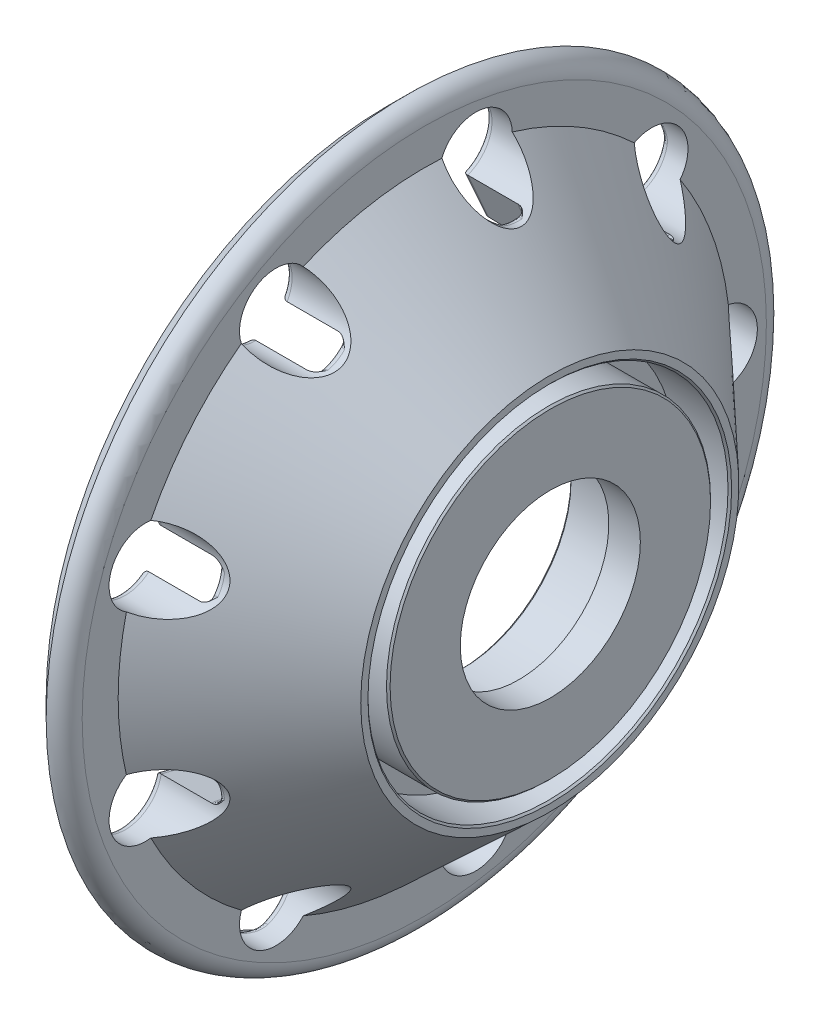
SolidWorks part; units mm, degrees
ref_plane "Plan de face" through (0, 0, 0) normal (0, 0, 1) x (1, 0, 0)
ref_plane "Plan de dessus" through (0, 0, 0) normal (0, 1, 0) x (1, 0, 0)
ref_plane "Plan de droite" through (0, 0, 0) normal (1, 0, 0) x (0, 0, -1)
ref_plane "Plan1" through (0, 0, 0) normal (0, 0, -1) x (-1, 0, 0)
sketch "Esquisse1" plane through (0, 0, 0) normal (0, 0, -1) x (-1, 0, 0)
  line L0 (0.0592, 21) -> (0.0592, 0)
  line L1 (0.0592, 0) -> (18, 0)
  line L2 (18, 0) -> (18, 38)
  line L3 (18, 38) -> (16, 40)
  line L4 (14, 38) -> (14, 34)
  line L5 (14, 34) -> (0.0592, 21)
  line L6 (0.0592, 0) -> (18, 0) construction
  arc A0 (16, 40) -> (14, 38) centre (16, 38) ccw
revolve "Révolution1" add sketch "Esquisse1" angle 360 about L6
sketch "Esquisse2" plane through (-18, 0, 0) normal (-1, 0, 0) x (0, 0, 1)
  line L0 (12.984, 26.489) -> (7.5426, 23.835)
  line L1 (7.5426, 23.835) -> (1.0643, 24.9773)
  line L2 (1.0643, 24.9773) -> (-3.1412, 29.3323)
  line L3 (-7.0805, 28.6377) -> (-9.5429, 23.107)
  line L4 (-9.5429, 23.107) -> (-15.2398, 19.8179)
  line L5 (-15.2398, 19.8179) -> (-21.2607, 20.4507)
  line L6 (-23.8319, 17.3865) -> (-22.1632, 11.567)
  line L7 (-22.1632, 11.567) -> (-24.4131, 5.3854)
  line L8 (-24.4131, 5.3854) -> (-29.4321, 2)
  line L9 (-29.4321, -2) -> (-24.4131, -5.3854)
  line L10 (-24.4131, -5.3854) -> (-22.1632, -11.567)
  line L11 (-22.1632, -11.567) -> (-23.8319, -17.3865)
  line L12 (-21.2607, -20.4507) -> (-15.2398, -19.8179)
  line L13 (-15.2398, -19.8179) -> (-9.5429, -23.107)
  line L14 (-9.5429, -23.107) -> (-7.0805, -28.6377)
  line L15 (-3.1412, -29.3323) -> (1.0643, -24.9773)
  line L16 (1.0643, -24.9773) -> (7.5426, -23.835)
  line L17 (7.5426, -23.835) -> (12.984, -26.489)
  line L18 (16.4481, -24.489) -> (16.8704, -18.4496)
  line L19 (16.8704, -18.4496) -> (21.0989, -13.4104)
  line L20 (21.0989, -13.4104) -> (26.9731, -11.9458)
  line L21 (28.3412, -8.187) -> (24.7827, -3.2891)
  line L22 (24.7827, -3.2891) -> (24.7827, 3.2891)
  line L23 (24.7827, 3.2891) -> (28.3412, 8.187)
  line L24 (26.9731, 11.9458) -> (21.0989, 13.4104)
  line L25 (21.0989, 13.4104) -> (16.8704, 18.4496)
  line L26 (16.8704, 18.4496) -> (16.4481, 24.489)
  arc A0 (-3.1412, 29.3323) -> (-7.0805, 28.6377) centre (-5.722, 32.4512) cw
  arc A1 (-21.2607, 20.4507) -> (-23.8319, 17.3865) centre (-25.2425, 21.181) cw
  arc A2 (-29.4321, 2) -> (-29.4321, -2) centre (-32.9518, 0) cw
  arc A3 (-23.8319, -17.3865) -> (-21.2607, -20.4507) centre (-25.2425, -21.181) cw
  arc A4 (-7.0805, -28.6377) -> (-3.1412, -29.3323) centre (-5.722, -32.4512) cw
  arc A5 (12.984, -26.489) -> (16.4481, -24.489) centre (16.4759, -28.5371) cw
  arc A6 (26.9731, -11.9458) -> (28.3412, -8.187) centre (30.9646, -11.2702) cw
  arc A7 (28.3412, 8.187) -> (26.9731, 11.9458) centre (30.9646, 11.2702) cw
  arc A8 (16.4481, 24.489) -> (12.984, 26.489) centre (16.4759, 28.5371) cw
extrude "Extrusion1" cut sketch "Esquisse2" against normal blind 8
draft "Dépouille1" type of draft neutral plane draft angle 2 faces to draft 9 parameters "D1"=2
ref_plane "Plan2" through (0, 28.5371, 0) normal (0, 1, 0) x (-1, 0, 0)
sketch "Esquisse3" plane through (0, 28.5371, 0) normal (0, 1, 0) x (-1, 0, 0)
  line L0 (8.5348, 16.4759) -> (8.5348, 12.4277)
  line L1 (8.5348, 12.4277) -> (14, 12.4277)
  line L2 (14, 12.4277) -> (14, 16.4759)
  line L3 (14, 16.4759) -> (8.5348, 16.4759)
  line L4 (14, 16.4759) -> (8.5348, 16.4759) construction
revolve "Révolution2" add sketch "Esquisse3" angle 360 about L3
ref_plane "Plan3" through (0, 0, 0) normal (0, 0.9397, 0.342) x (-1, 0, 0)
sketch "Esquisse4" plane through (0, 0, 0) normal (0, 0.9397, 0.342) x (-1, 0, 0)
  line L0 (8.5348, 37) -> (8.5348, 32.9518)
  line L1 (8.5348, 32.9518) -> (14, 32.9518)
  line L2 (14, 32.9518) -> (14, 37)
  line L3 (14, 37) -> (8.5348, 37)
  line L4 (8.5348, 32.9518) -> (14, 32.9518) construction
revolve "Révolution3" add sketch "Esquisse4" angle 360 about L1
ref_plane "Plan4" through (0, 0, 0) normal (0, 0.5, 0.866) x (1, 0, 0)
sketch "Esquisse5" plane through (0, 0, 0) normal (0, 0.5, 0.866) x (1, 0, 0)
  line L0 (-8.5348, -37) -> (-8.5348, -32.9518)
  line L1 (-8.5348, -32.9518) -> (-14, -32.9518)
  line L2 (-14, -32.9518) -> (-14, -37)
  line L3 (-14, -37) -> (-8.5348, -37)
  line L4 (-8.5348, -32.9518) -> (-14, -32.9518) construction
revolve "Révolution4" add sketch "Esquisse5" angle 360 about L4
ref_plane "Plan5" through (0, 0, 0) normal (0, -0.1736, 0.9848) x (1, 0, 0)
sketch "Esquisse6" plane through (0, 0, 0) normal (0, -0.1736, 0.9848) x (1, 0, 0)
  line L0 (-8.5348, -37) -> (-8.5348, -32.9518)
  line L1 (-8.5348, -32.9518) -> (-14, -32.9518)
  line L2 (-14, -32.9518) -> (-14, -37)
  line L3 (-14, -37) -> (-8.5348, -37)
  line L4 (-8.5348, -32.9518) -> (-14, -32.9518) construction
revolve "Révolution5" add sketch "Esquisse6" angle 360 about L1
ref_plane "Plan6" through (0, 0, 0) normal (0, 0.766, -0.6428) x (-1, 0, 0)
sketch "Esquisse7" plane through (0, 0, 0) normal (0, 0.766, -0.6428) x (-1, 0, 0)
  line L0 (8.5348, -28.9036) -> (8.5348, -32.9518)
  line L1 (8.5348, -32.9518) -> (14, -32.9518)
  line L2 (14, -32.9518) -> (14, -28.9036)
  line L3 (14, -28.9036) -> (8.5348, -28.9036)
  line L4 (8.5348, -32.9518) -> (14, -32.9518) construction
revolve "Révolution6" add sketch "Esquisse7" angle 360 about L1
sketch "Esquisse8" plane through (0, 0, 0) normal (0, 1, 0) x (1, 0, 0)
  line L0 (-8.5348, 32.9518) -> (-8.5348, 37)
  line L1 (-8.5348, 37) -> (-14, 37)
  line L2 (-14, 37) -> (-14, 32.9518)
  line L3 (-14, 32.9518) -> (-8.5348, 32.9518)
  line L4 (-14, 32.9518) -> (-8.5348, 32.9518) construction
revolve "Révolution7" add sketch "Esquisse8" angle 360 about L3
ref_plane "Plan7" through (0, 0, 0) normal (0, 0.766, 0.6428) x (-1, 0, 0)
sketch "Esquisse9" plane through (0, 0, 0) normal (0, 0.766, 0.6428) x (-1, 0, 0)
  line L0 (8.5348, -32.9518) -> (8.5348, -37)
  line L1 (8.5348, -37) -> (14, -37)
  line L2 (14, -37) -> (14, -32.9518)
  line L3 (14, -32.9518) -> (8.5348, -32.9518)
  line L4 (14, -32.9518) -> (8.5348, -32.9518) construction
revolve "Révolution8" add sketch "Esquisse9" angle 360 about L3
ref_plane "Plan8" through (0, 0, 0) normal (0, 0.1736, 0.9848) x (1, 0, 0)
sketch "Esquisse10" plane through (0, 0, 0) normal (0, 0.1736, 0.9848) x (1, 0, 0)
  line L0 (-8.5348, 28.9036) -> (-8.5348, 32.9518)
  line L1 (-8.5348, 32.9518) -> (-14, 32.9518)
  line L2 (-14, 32.9518) -> (-14, 28.9036)
  line L3 (-14, 28.9036) -> (-8.5348, 28.9036)
  line L4 (-8.5348, 32.9518) -> (-14, 32.9518) construction
revolve "Révolution9" add sketch "Esquisse10" angle 360 about L4
ref_plane "Plan9" through (0, 0, 0) normal (0, 0.9397, -0.342) x (-1, 0, 0)
sketch "Esquisse11" plane through (0, 0, 0) normal (0, 0.9397, -0.342) x (-1, 0, 0)
  line L0 (8.5348, 37) -> (8.5348, 32.9518)
  line L1 (8.5348, 32.9518) -> (14, 32.9518)
  line L2 (14, 32.9518) -> (14, 37)
  line L3 (14, 37) -> (8.5348, 37)
  line L4 (8.5348, 32.9518) -> (14, 32.9518) construction
revolve "Révolution10" add sketch "Esquisse11" angle 360 about L1
hole_wizard "Perçage1" positions "Esquisse13" profile "Esquisse12" legacy
sketch "Esquisse13" plane through (-0.0592, 0, 0) normal (1, 0, 0) x (0, 0, -1)
  point P0 (0, 0)
sketch "Esquisse12" plane through (-0.0592, 0, 0) normal (0, 1, 0) x (0, 0, -1)
  line L0 (0, 0) -> (0, 5.9408)
  line L1 (0, 5.9408) -> (20, 5.9408)
  line L2 (20, 5.9408) -> (20, 0)
  line L3 (20, 0) -> (0, 0)
  line L4 (0, 110) -> (0, -10) construction
  dimension "Diamètre" = 40
  dimension "Profondeur" = 5.9408
sketch "Esquisse14" plane through (0, 0, 0) normal (0, 1, 0) x (1, 0, 0)
  line L0 (-18, 37) -> (-18, 0)
  line L1 (-18, 0) -> (-17, 0)
  line L2 (-17, 0) -> (-17, 37)
  line L3 (-17, 37) -> (-18, 37)
  line L4 (-18, 0) -> (-17, 0) construction
revolve "Enlèvement de matière-Révolution1" cut sketch "Esquisse14" angle 360 about L1
ref_plane "Plan10" through (0, 0, 16.4759) normal (0, 0, 1) x (1, 0, 0)
sketch "Esquisse15" plane through (0, 0, 16.4759) normal (0, 0, 1) x (1, 0, 0)
  line L0 (-17, 32.5853) -> (-17, 28.5371)
  line L1 (-17, 28.5371) -> (-8.5348, 28.5371)
  line L2 (-8.5348, 28.5371) -> (-8.5348, 32.5853)
  line L3 (-8.5348, 32.5853) -> (-17, 32.5853)
  line L4 (-17, 28.5371) -> (-8.5348, 28.5371) construction
revolve "Enlèvement de matière-Révolution2" cut sketch "Esquisse15" angle 360 about L1
ref_plane "Plan11" through (0, 0, 30.9646) normal (0, 0, 1) x (1, 0, 0)
sketch "Esquisse16" plane through (0, 0, 30.9646) normal (0, 0, 1) x (1, 0, 0)
  line L0 (-17, 15.3184) -> (-17, 11.2702)
  line L1 (-17, 11.2702) -> (-8.5348, 11.2702)
  line L2 (-8.5348, 11.2702) -> (-8.5348, 15.3184)
  line L3 (-8.5348, 15.3184) -> (-17, 15.3184)
  line L4 (-17, 11.2702) -> (-8.5348, 11.2702) construction
revolve "Enlèvement de matière-Révolution3" cut sketch "Esquisse16" angle 360 about L1
ref_plane "Plan12" through (0, 0, 30.9646) normal (0, 0, 1) x (1, 0, 0)
sketch "Esquisse17" plane through (0, 0, 30.9646) normal (0, 0, 1) x (1, 0, 0)
  line L0 (-17, -7.222) -> (-17, -11.2702)
  line L1 (-17, -11.2702) -> (-8.5348, -11.2702)
  line L2 (-8.5348, -11.2702) -> (-8.5348, -7.222)
  line L3 (-8.5348, -7.222) -> (-17, -7.222)
  line L4 (-17, -11.2702) -> (-8.5348, -11.2702) construction
revolve "Enlèvement de matière-Révolution4" cut sketch "Esquisse17" angle 360 about L1
ref_plane "Plan13" through (0, 0, 16.4759) normal (0, 0, 1) x (1, 0, 0)
sketch "Esquisse18" plane through (0, 0, 16.4759) normal (0, 0, 1) x (1, 0, 0)
  line L0 (-17, -24.4889) -> (-17, -28.5371)
  line L1 (-17, -28.5371) -> (-8.5348, -28.5371)
  line L2 (-8.5348, -28.5371) -> (-8.5348, -24.4889)
  line L3 (-8.5348, -24.4889) -> (-17, -24.4889)
  line L4 (-17, -28.5371) -> (-8.5348, -28.5371) construction
revolve "Enlèvement de matière-Révolution5" cut sketch "Esquisse18" angle 360 about L1
ref_plane "Plan14" through (0, 0, -5.722) normal (0, 0, 1) x (1, 0, 0)
sketch "Esquisse19" plane through (0, 0, -5.722) normal (0, 0, 1) x (1, 0, 0)
  line L0 (-17, -28.403) -> (-17, -32.4512)
  line L1 (-17, -32.4512) -> (-8.5348, -32.4512)
  line L2 (-8.5348, -32.4512) -> (-8.5348, -28.403)
  line L3 (-8.5348, -28.403) -> (-17, -28.403)
  line L4 (-17, -32.4512) -> (-8.5348, -32.4512) construction
revolve "Enlèvement de matière-Révolution6" cut sketch "Esquisse19" angle 360 about L1
ref_plane "Plan15" through (0, 0, -25.2425) normal (0, 0, 1) x (1, 0, 0)
sketch "Esquisse20" plane through (0, 0, -25.2425) normal (0, 0, 1) x (1, 0, 0)
  line L0 (-17, -17.1328) -> (-17, -21.181)
  line L1 (-17, -21.181) -> (-8.5348, -21.181)
  line L2 (-8.5348, -21.181) -> (-8.5348, -17.1328)
  line L3 (-8.5348, -17.1328) -> (-17, -17.1328)
  line L4 (-17, -21.181) -> (-8.5348, -21.181) construction
revolve "Enlèvement de matière-Révolution7" cut sketch "Esquisse20" angle 360 about L1
ref_plane "Plan16" through (0, 0, -32.9518) normal (0, 0, 1) x (1, 0, 0)
sketch "Esquisse21" plane through (0, 0, -32.9518) normal (0, 0, 1) x (1, 0, 0)
  line L0 (-17, 4.0482) -> (-17, 0)
  line L1 (-17, 0) -> (-8.5348, 0)
  line L2 (-8.5348, 0) -> (-8.5348, 4.0482)
  line L3 (-8.5348, 4.0482) -> (-17, 4.0482)
  line L4 (-17, 0) -> (-8.5348, 0) construction
revolve "Enlèvement de matière-Révolution8" cut sketch "Esquisse21" angle 360 about L1
ref_plane "Plan17" through (0, 0, -25.2425) normal (0, 0, 1) x (1, 0, 0)
sketch "Esquisse22" plane through (0, 0, -25.2425) normal (0, 0, 1) x (1, 0, 0)
  line L0 (-17, 25.2292) -> (-17, 21.181)
  line L1 (-17, 21.181) -> (-8.5348, 21.181)
  line L2 (-8.5348, 21.181) -> (-8.5348, 25.2292)
  line L3 (-8.5348, 25.2292) -> (-17, 25.2292)
  line L4 (-17, 21.181) -> (-8.5348, 21.181) construction
revolve "Enlèvement de matière-Révolution9" cut sketch "Esquisse22" angle 360 about L1
ref_plane "Plan18" through (0, 0, -5.722) normal (0, 0, 1) x (1, 0, 0)
sketch "Esquisse23" plane through (0, 0, -5.722) normal (0, 0, 1) x (1, 0, 0)
  line L0 (-17, 36.4994) -> (-17, 32.4512)
  line L1 (-17, 32.4512) -> (-8.5348, 32.4512)
  line L2 (-8.5348, 32.4512) -> (-8.5348, 36.4994)
  line L3 (-8.5348, 36.4994) -> (-17, 36.4994)
  line L4 (-17, 32.4512) -> (-8.5348, 32.4512) construction
revolve "Enlèvement de matière-Révolution10" cut sketch "Esquisse23" angle 360 about L1
sketch "Esquisse24" plane through (0, 0, 0) normal (0, 0, -1) x (-1, 0, 0)
  line L0 (0, 18) -> (0, 0)
  line L1 (0, 0) -> (6, 0)
  line L2 (6, 0) -> (6, 18)
  line L3 (6, 18) -> (0, 18)
  line L4 (0, 0) -> (6, 0) construction
revolve "Révolution11" add sketch "Esquisse24" angle 360 about L1
fillet "Congé7" radius 0.75 9 edges at (-10, 25.0312, 14.4518) (-10, 0, -28.9036) (-10, -18.5789, -22.1414) (-10, -28.4645, -5.0191) (-10, -25.0312, 14.4518) (-10, -9.8856, 27.1605) (-10, 9.8856, 27.1605) (-10, 18.5789, -22.1414) (-10, 28.4645, -5.0191)
fillet "Congé8" radius 0.75 45 edges at (-9.835, 26.3656, 12.7311) (-9.7175, 24.3253, 16.4596) (-10, 15.93, 18.9846) (-10, 12.769, 23.6712) (-10, 5.4339, 26.341) (-10, 0, 24.7827) (-10, -5.4339, 26.341) (-10, -12.769, 23.6712) (-10, -15.93, 18.9846) (-10, -21.0943, 16.6855) (-10, -24.9972, 9.9254) (-10, -24.4062, 4.3035) (-10, -26.8844, -0.7773) (-10, -25.5289, -8.4646) (-10, -21.4624, -12.3913) (-10, -20.095, -17.8764) (-10, -14.1154, -22.8939) (-10, -8.4762, -23.2881) (-10, -3.9029, -26.6109) (-10, 3.9029, -26.6109) (-10, 8.4762, -23.2881) (-10, 14.1154, -22.8939) (-10, 20.095, -17.8764) (-10, 21.4624, -12.3913) (-10, 25.5289, -8.4646) (-10, 26.8844, -0.7773) (-10, 24.4062, 4.3035) (-10, 24.9972, 9.9254) (-10, 21.0943, 16.6855) (-9.835, 17.116, -23.7543) (-9.7175, 20.4335, -21.0976) (-9.835, 28.3806, -7.1949) (-9.7175, 29.2143, -3.0273) (-9.835, 12.0138, 26.7001) (-9.7175, 8.0543, 28.2448) (-9.835, -7.9593, 28.1758) (-9.7175, -11.9854, 26.814) (-9.835, -24.2082, 16.4677) (-9.7175, -26.4171, 12.8366) (-9.835, -29.1299, -2.9457) (-9.7175, -28.4878, -7.1472) (-9.835, -20.4213, -20.9809) (-9.7175, -17.2288, -23.7867) (-9.835, -2.1574, -29.1988) (-9.7175, 2.0917, -29.2961)
hole_wizard "Perçage2" positions "Esquisse26" profile "Esquisse25" legacy
sketch "Esquisse26" plane through (-10, 0, 0) normal (-1, 0, 0) x (0, 0, 1)
  point P0 (0, 0)
sketch "Esquisse25" plane through (-10, 0, 0) normal (0, 1, 0) x (0, 0, 1)
  line L0 (0, 0) -> (0, 10)
  line L1 (0, 10) -> (10, 10)
  line L2 (10, 10) -> (10, 6.5)
  line L3 (10, 6.5) -> (12, 6.5)
  line L4 (12, 6.5) -> (12, 0)
  line L5 (12, 0) -> (0, 0)
  line L6 (0, 110) -> (0, -10) construction
  dimension "Diamètre" = 20
  dimension "Profondeur" = 10
  dimension "Diamètre chambrage" = 24
  dimension "Profondeur chambrage" = 6.5
chamfer "Chanfrein1" distance 0.2 angle 45 1 edges at (0, 0, 18)
chamfer "Chanfrein2" distance 0.2 angle 45 1 edges at (-0.0592, 0, -20)
hole_wizard "Trou taraudé M25" positions "Esquisse3D3" profile "Esquisse35" tap size "M2" standard "ISO"
sketch3d "Esquisse3D3"
  line L0 (6.631, 0, 0) -> (-61.2619, 0, 0) construction
  point P0 (-10, 0, -16)
  dimension "D1" = 16
sketch "Esquisse35" plane through (-10, 0, -16) normal (0, 1, 0) x (0, 0, 1)
  line L0 (0, 0) -> (0, 8.3004)
  line L1 (0, 8.3004) -> (0.5, 8)
  line L2 (0.5, 8) -> (0.5, 0)
  line L5 (0.5, 0) -> (0, 0)
  line L10 (0, 8.3004) -> (-0.5, 8) construction
  line L11 (0, -6.35) -> (0, 107.95) construction
  dimension "Diamètre du trou pour taraudage" = 1
  dimension "Profondeur du trou pour taraudage" = 8
  dimension "Angle de pointe" = 118
hole_wizard "Trou taraudé M22" positions "Esquisse28" profile "Esquisse27" tap size "M2" standard "ISO"
sketch "Esquisse28" plane through (-10, 0, 0) normal (-1, 0, 0) x (0, 0, 1)
  point P0 (8, -13.8564)
sketch "Esquisse27" plane through (-10, -13.8564, 8) normal (0, 1, 0) x (0, 0, 1)
  line L0 (0, 0) -> (0, 8.3004)
  line L1 (0, 8.3004) -> (0.5, 8)
  line L2 (0.5, 8) -> (0.5, 0)
  line L5 (0.5, 0) -> (0, 0)
  line L10 (0, 8.3004) -> (-0.5, 8) construction
  line L11 (0, -6.35) -> (0, 107.95) construction
  dimension "Diamètre du trou pour taraudage" = 1
  dimension "Profondeur du trou pour taraudage" = 8
  dimension "Angle de pointe" = 118
hole_wizard "Trou taraudé M26" positions "Esquisse30" profile "Esquisse29" tap size "M2" standard "ISO"
sketch "Esquisse30" plane through (-10, 0, 0) normal (-1, 0, 0) x (0, 0, 1)
  point P0 (8, 13.8564)
sketch "Esquisse29" plane through (-10, 13.8564, 8) normal (0, 1, 0) x (0, 0, 1)
  line L0 (0, 0) -> (0, 8.3004)
  line L1 (0, 8.3004) -> (0.5, 8)
  line L2 (0.5, 8) -> (0.5, 0)
  line L5 (0.5, 0) -> (0, 0)
  line L10 (0, 8.3004) -> (-0.5, 8) construction
  line L11 (0, -6.35) -> (0, 107.95) construction
  dimension "Diamètre du trou pour taraudage" = 1
  dimension "Profondeur du trou pour taraudage" = 8
  dimension "Angle de pointe" = 118
chamfer "Chanfrein3" distance 0.3 angle 45 1 edges at (-10, 0, 12)
fillet "Congé1" radius 0.2 1 edges at (-3.5, 0, 12)
fillet "Congé9" radius 0.75 9 edges at (-17, 23.7831, 28.3436) (-17, 0, 37) (-17, -23.7831, 28.3436) (-17, -36.4379, 6.425) (-17, -32.0429, -18.5) (-17, -12.6547, -34.7686) (-17, 12.6547, -34.7686) (-17, 32.0429, -18.5) (-17, 36.4379, 6.425)
fillet "Congé12" radius 0.75 63 edges at (-17.0931, -22.1085, -29.1831) (-17.0931, -24.9006, -26.8402) (-17, -17.9096, -27.627) (-17, -24.0973, -22.4349) (-17.0931, 1.8224, -36.5666) (-17.0931, 22.1085, -29.1831) (-17.0931, 24.9006, -26.8402) (-17.0931, 35.6946, -8.1444) (-17.0931, 36.3275, -4.555) (-17.0931, 32.5788, 16.7051) (-17.0931, 30.7564, 19.8615) (-17.0931, 14.219, 33.7381) (-17.0931, 10.794, 34.9847) (-17.0931, -10.794, 34.9847) (-17.0931, -14.219, 33.7381) (-17.0931, -30.7564, 19.8615) (-17.0931, -32.5788, 16.7051) (-17.0931, -36.3275, -4.555) (-17.0931, -1.8224, -36.5666) (-17.0931, -35.6946, -8.1444) (-17, 14.6766, -23.0548) (-17, 8.5598, -23.5178) (-17, 3.5764, -27.095) (-17, 4.0388, -32.6756) (-17, 17.9096, -27.627) (-17, 26.0623, -8.2271) (-17, 21.6741, -12.5136) (-17, 20.156, -18.4571) (-17, 24.0973, -22.4349) (-17, 31.4778, -9.6515) (-17, 25.2532, 10.4502) (-17, 24.6469, 4.3459) (-17, 27.3044, -1.1829) (-17, 32.8805, -1.6966) (-17, 30.3173, 12.8401) (-17, 12.6278, 24.2377) (-17, 16.0871, 19.1719) (-17, 21.6767, 16.6448) (-17, 26.2785, 19.8355) (-17, 14.9709, 29.3237) (-17, -5.9063, 26.6842) (-17, 0, 25.0271) (-17, 5.9063, 26.6842) (-17, 7.3805, 32.0863) (-17, -7.3805, 32.0863) (-17, -21.6767, 16.6448) (-17, -16.0871, 19.1719) (-17, -12.6278, 24.2377) (-17, -14.9709, 29.3237) (-17, -26.2785, 19.8355) (-17, -27.3044, -1.1829) (-17, -24.6469, 4.3459) (-17, -25.2532, 10.4502) (-17, -30.3173, 12.8401) (-17, -32.8805, -1.6966) (-17, -3.5764, -27.095) (-17, -8.5598, -23.5178) (-17, -14.6766, -23.0548) (-17, -4.0388, -32.6756) (-17, -20.156, -18.4571) (-17, -21.6741, -12.5136) (-17, -26.0623, -8.2271) (-17, -31.4778, -9.6515)
